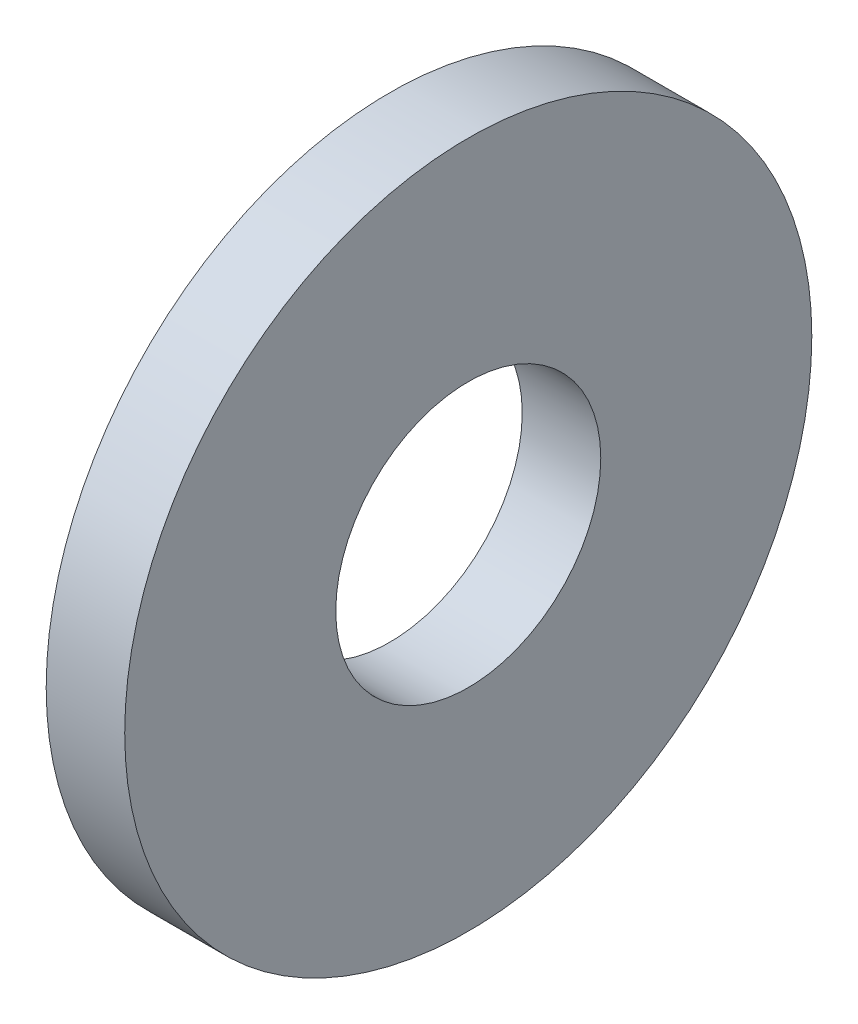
SolidWorks part; units mm, degrees
ref_plane "Plane1" through (0, 0, 0) normal (0, 0, 1) x (1, 0, 0)
ref_plane "Plane2" through (0, 0, 0) normal (0, 1, 0) x (1, 0, 0)
ref_plane "Plane3" through (0, 0, 0) normal (1, 0, 0) x (0, 0, -1)
other "Configuration Table"
sketch "Sketch1" plane through (0, 0, 0) normal (1, 0, 0) x (0, 0, -1)
  circle A0 centre (0, 0) radius 2.7
  circle A1 centre (0, 0) radius 7
  dimension "Insid_dia" = 5.4
  dimension "OutsideDia" = 14
extrude "Base-Extrude" add sketch "Sketch1" along normal blind 1.6
